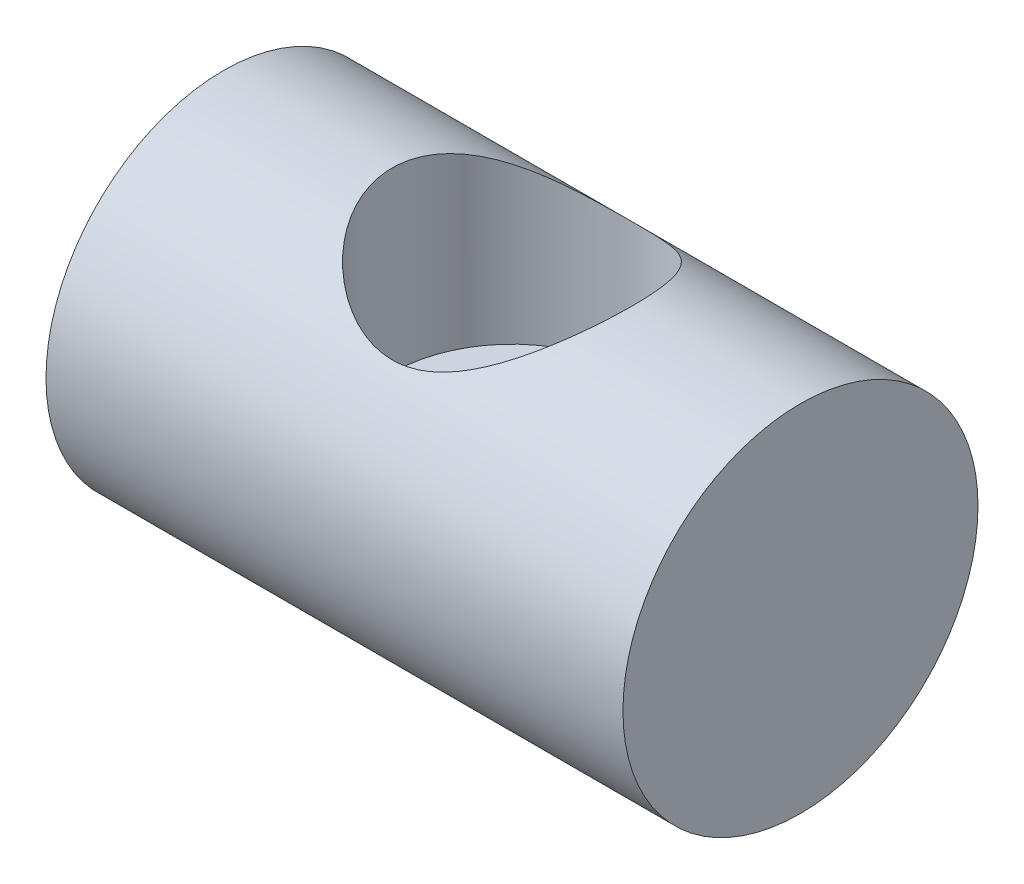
SolidWorks part; units mm, degrees
ref_plane "Vorne" through (0, 0, 0) normal (0, 0, 1) x (1, 0, 0)
ref_plane "Oben" through (0, 0, 0) normal (0, 1, 0) x (1, 0, 0)
ref_plane "Rechts" through (0, 0, 0) normal (1, 0, 0) x (0, 0, -1)
sketch "Skizze1" plane through (0, 0, 0) normal (1, 0, 0) x (0, 0, -1)
  circle A0 centre (0, 0) radius 10
  dimension "D1" = 20
extrude "Aufsatz-Linear austragen1" add sketch "Skizze1" along normal mid plane 32.5
sketch "Skizze2" plane through (0, 0, 0) normal (0, 0, 1) x (1, 0, 0)
  line L0 (16.25, 10) -> (-16.25, 10) construction
  point P0 (0, 10)
hole_wizard "M8 Gewindebohrung1" positions "3D-Skizze1" profile "Skizze3" tap size "M8" standard "DIN"
sketch3d "3D-Skizze1"
  point P0 (0, 10, 0)
sketch "Skizze3" plane through (0, 10, 0) normal (1, 0, 0) x (0, 0, 1)
  line L0 (0, 0) -> (0, 20)
  line L1 (0, 20) -> (3.4, 20)
  line L2 (3.4, 20) -> (3.4, 0)
  line L5 (3.4, 0) -> (0, 0)
  line L11 (0, -6.35) -> (0, 107.95) construction
  dimension "Bohrerdurchmesser" = 6.8
  dimension "Bohrungstiefe" = 20
hole_wizard "Stirnsenkung für M8 Zylinderschraube mit Innensechskant1" positions "3D-Skizze2" profile "Skizze4" counterbore size "M8" standard "DIN"
sketch3d "3D-Skizze2"
  point P0 (0, 10, 0)
sketch "Skizze4" plane through (0, 10, 0) normal (1, 0, 0) x (0, 0, 1)
  line L0 (0, 0) -> (0, 20)
  line L1 (0, 20) -> (4.25, 20)
  line L3 (4.25, 20) -> (4.25, 10)
  line L4 (4.25, 10) -> (6.75, 10)
  line L5 (6.75, 10) -> (6.75, 0)
  line L7 (6.75, 0) -> (0, 0)
  line L11 (0, -6.35) -> (0, 107.95) construction
  dimension "Bohrerdurchmesser" = 8.5
  dimension "Bohrungstiefe" = 20
  dimension "Senkdurchmesser2" = 13.5
  dimension "Senktiefe2" = 10
